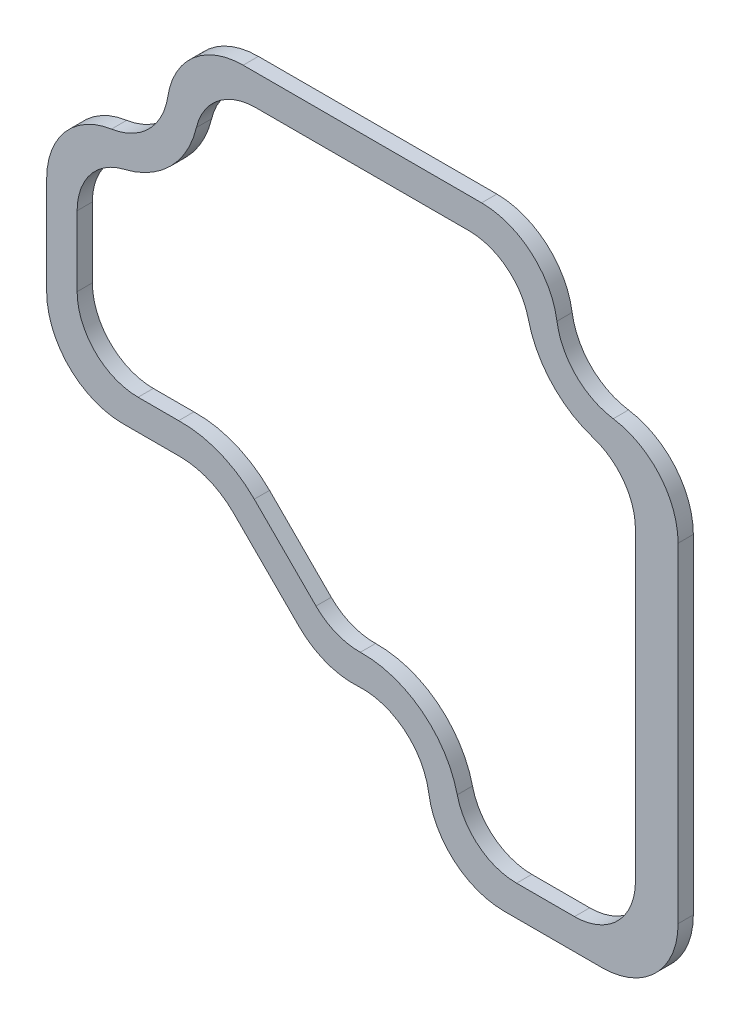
SolidWorks part; units mm, degrees
ref_plane "Front Plane" through (0, 0, 0) normal (0, 0, 1) x (1, 0, 0)
ref_plane "Top Plane" through (0, 0, 0) normal (0, 1, 0) x (1, 0, 0)
ref_plane "Right Plane" through (0, 0, 0) normal (1, 0, 0) x (0, 0, -1)
sketch "Sketch1" plane through (0, 0, 0) normal (0, 0, 1) x (1, 0, 0)
  line L0 (-12.4219, 31.369) -> (12.4219, 31.369)
  line L1 (14.7561, -31.369) -> (24.9555, -31.369)
  line L2 (32.893, -23.4315) -> (32.893, 10.8979)
  line L3 (-6.5841, -16.3758) -> (-13.3961, -9.5638)
  line L4 (-19.0087, -7.239) -> (-24.9555, -7.239)
  line L5 (-32.893, 0.6985) -> (-32.893, 10.8979)
  line L6 (-19.1413, -4.064) -> (-23.368, -4.064)
  line L7 (-29.718, 2.286) -> (-29.718, 9.5896)
  line L8 (-11.1136, 28.194) -> (11.1136, 28.194)
  line L9 (28.448, 9.945) -> (28.448, -21.844)
  line L10 (22.098, -28.194) -> (16.0644, -28.194)
  line L11 (-4.8321, -13.6377) -> (-11.2616, -7.2082)
  arc A0 (-26.1377, 18.7469) -> (-20.2709, 24.6137) centre (-27.178, 25.654) ccw
  arc A1 (20.2709, 24.6137) -> (26.1377, 18.7469) centre (27.178, 25.654) ccw
  arc A2 (6.9071, -24.6137) -> (-0.4547, -18.6838) centre (0, -25.654) ccw
  arc A3 (20.2709, 24.6137) -> (12.4219, 31.369) centre (12.4219, 23.4315) ccw
  arc A4 (-12.4219, 31.369) -> (-20.2709, 24.6137) centre (-12.4219, 23.4315) ccw
  arc A5 (-26.1377, 18.7469) -> (-32.893, 10.8979) centre (-24.9555, 10.8979) ccw
  arc A6 (-6.5841, -16.3758) -> (-0.4547, -18.6838) centre (-0.9714, -10.7632) ccw
  arc A7 (6.9071, -24.6137) -> (14.7561, -31.369) centre (14.7561, -23.4315) ccw
  arc A8 (24.9555, -31.369) -> (32.893, -23.4315) centre (24.9555, -23.4315) ccw
  arc A9 (32.893, 10.8979) -> (26.1377, 18.7469) centre (24.9555, 10.8979) ccw
  arc A10 (-32.893, 0.6985) -> (-24.9555, -7.239) centre (-24.9555, 0.6985) ccw
  arc A11 (-13.3961, -9.5638) -> (-19.0087, -7.239) centre (-19.0087, -15.1765) ccw
  arc A12 (-23.368, -4.064) -> (-29.718, 2.286) centre (-23.368, 2.286) cw
  arc A13 (-29.718, 9.5896) -> (-24.8334, 15.7682) centre (-23.368, 9.5896) cw
  arc A14 (-24.8334, 15.7682) -> (-17.2922, 23.3094) centre (-27.178, 25.654) ccw
  arc A15 (-17.2922, 23.3094) -> (-11.1136, 28.194) centre (-11.1136, 21.844) cw
  arc A16 (11.1136, 28.194) -> (17.2922, 23.3094) centre (11.1136, 21.844) cw
  arc A17 (17.2922, 23.3094) -> (24.0518, 15.9869) centre (27.178, 25.654) ccw
  arc A18 (24.0518, 15.9869) -> (28.448, 9.945) centre (22.098, 9.945) cw
  arc A19 (28.448, -21.844) -> (22.098, -28.194) centre (22.098, -21.844) cw
  arc A20 (16.0644, -28.194) -> (9.8858, -23.3094) centre (16.0644, -21.844) cw
  arc A21 (9.8858, -23.3094) -> (-0.2105, -15.4962) centre (0, -25.654) ccw
  arc A22 (-0.2105, -15.4962) -> (-4.8321, -13.6377) centre (-0.342, -9.1475) cw
  arc A23 (-11.2616, -7.2082) -> (-19.1413, -4.064) centre (-18.8612, -14.8079) ccw
  dimension "D1" = 6.985
  dimension "D2" = 7.9375
  dimension "D3" = 6.35
  dimension "D4" = 10.16
  dimension "D5" = 10.7475
  dimension "D6" = 6.9071
  dimension "D7" = 9.8858
  dimension "D8" = 11.1136
  dimension "D9" = 12.4219
  dimension "D10" = 17.2922
  dimension "D11" = 24.0518
  dimension "D12" = 26.1377
  dimension "D13" = 0.2105
  dimension "D14" = 0.4547
  dimension "D15" = 4.8321
  dimension "D16" = 6.5841
  dimension "D17" = 11.1136
  dimension "D18" = 11.2616
  dimension "D19" = 13.3961
  dimension "D20" = 24.8334
  dimension "D21" = 9.5896
  dimension "D32" = 19.1413
extrude "Boss-Extrude1" add sketch "Sketch1" along normal blind 1.5875
